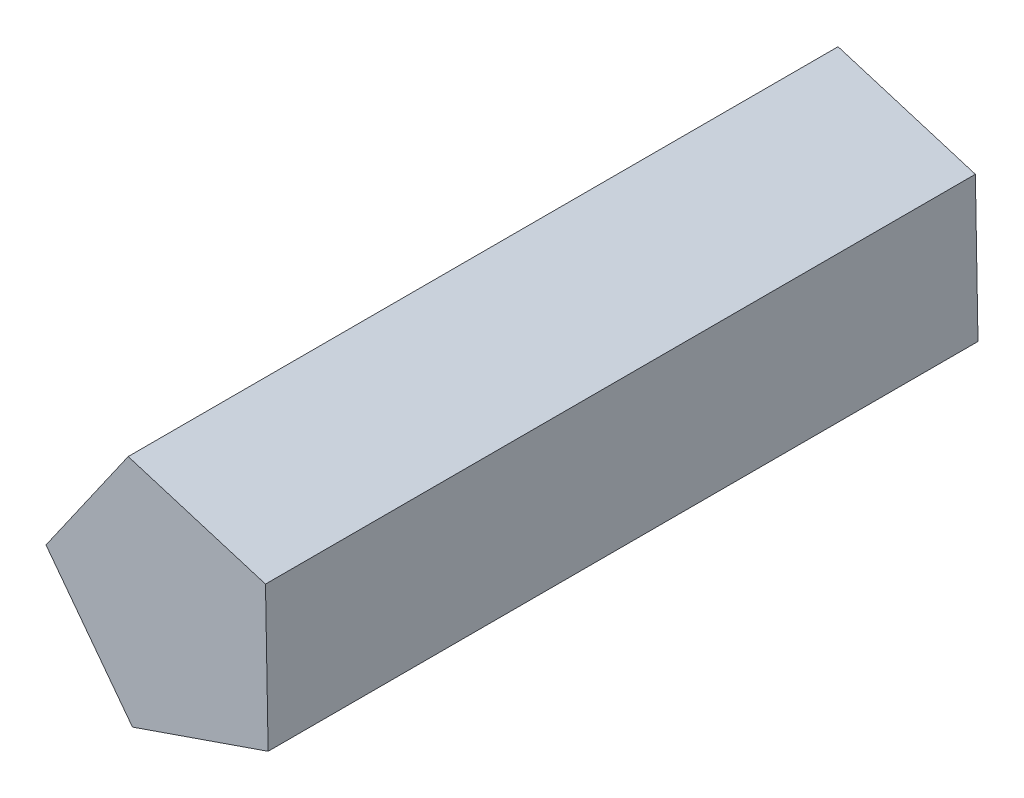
SolidWorks part; units mm, degrees
ref_plane "Front Plane" through (0, 0, 0) normal (0, 0, 1) x (1, 0, 0)
ref_plane "Top Plane" through (0, 0, 0) normal (0, 1, 0) x (1, 0, 0)
ref_plane "Right Plane" through (0, 0, 0) normal (1, 0, 0) x (0, 0, -1)
sketch "Sketch1" plane through (0, 0, 0) normal (0, 0, 1) x (1, 0, 0)
  line L7 (14.0539, 2.2543) -> (13.9971, 5.3416)
  line L8 (13.9971, 5.3416) -> (11.0433, 6.2415)
  line L9 (11.0433, 6.2415) -> (9.2747, 3.7104)
  line L10 (9.2747, 3.7104) -> (11.1353, 1.2462)
  line L11 (11.1353, 1.2462) -> (14.0539, 2.2543)
  circle A0 centre (11.9009, 3.7588) radius 2.125 construction
  point P1 (0, 0)
  dimension "D1" = 4.25
extrude "Boss-Extrude1" add sketch "Sketch1" along normal blind 24 contours L7 L8 L9 L10 L11
scale "Scale1" scale about centroid uniform scaling no x scale factor 1.571429 y scale factor 1.571429 z scale factor 1
